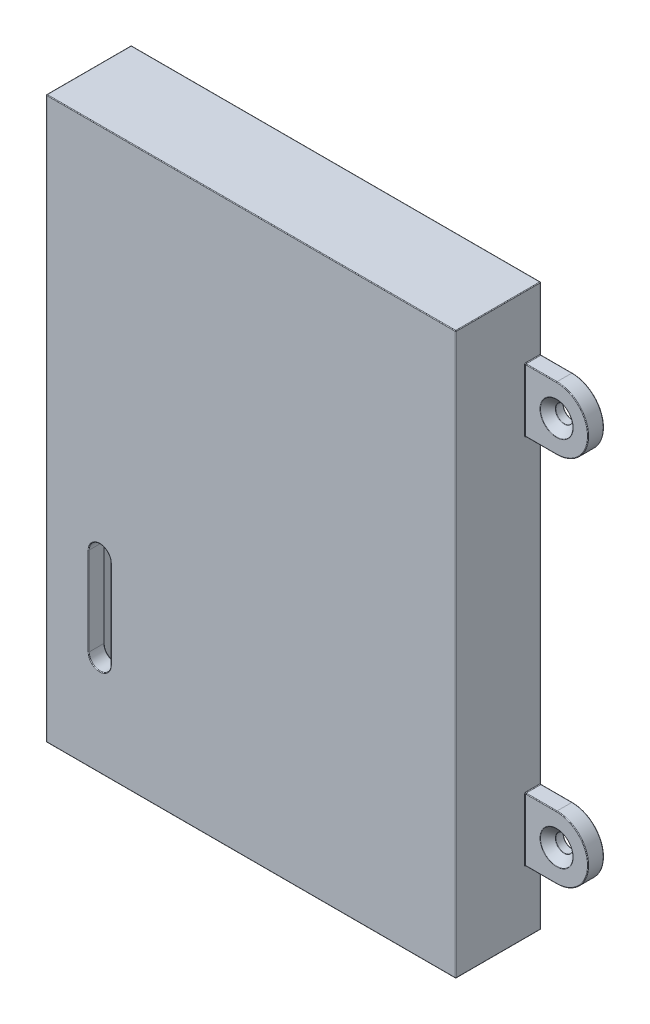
SolidWorks part; units mm, degrees
ref_plane "Ebene vorne" through (0, 0, 0) normal (0, 0, 1) x (1, 0, 0)
ref_plane "Ebene oben" through (0, 0, 0) normal (0, 1, 0) x (1, 0, 0)
ref_plane "Ebene rechts" through (0, 0, 0) normal (1, 0, 0) x (0, 0, -1)
sketch "Skizze2" plane through (0, 0, 0) normal (0, 0, 1) x (1, 0, 0)
  line L0 (-44.4888, 255.9158) -> (-44.4888, -114.3566) construction
  line L1 (-100.4888, 75.2911) -> (29.5112, 75.2911)
  line L2 (-100.4888, 75.2911) -> (-100.4888, -102.7089)
  line L3 (-100.4888, -102.7089) -> (29.5112, -102.7089)
  line L4 (29.5112, 75.2911) -> (29.5112, -102.7089)
  point P7 (-44.4888, 70.7796)
  dimension "D1" = 178
  dimension "D2" = 130
extrude "Aufsatz-Linear austragen1" add sketch "Skizze2" along normal blind 27
sketch "Skizze7" plane through (0, 0, 0) normal (0, 0, 1) x (1, 0, 0)
  line L0 (-103.4013, -18.7089) -> (17.3921, -18.7089) construction
  line L1 (-35.4888, 75.2911) -> (-35.4888, -109.3611) construction
  line L2 (29.5112, 75.2911) -> (-100.4888, 75.2911) construction
  line L3 (39.5112, 45.2911) -> (-110.4888, 45.2911) construction
  line L4 (39.5112, 35.2911) -> (-110.4888, 35.2911)
  line L5 (39.5112, 55.2911) -> (-110.4888, 55.2911)
  line L6 (39.5112, -72.7089) -> (-110.4888, -72.7089) construction
  line L9 (39.5112, -82.7089) -> (-110.4888, -82.7089)
  line L11 (39.5112, -62.7089) -> (-110.4888, -62.7089)
  line L12 (-100.4888, -102.7089) -> (29.5112, -102.7089) construction
  arc A0 (39.5112, 35.2911) -> (39.5112, 55.2911) centre (39.5112, 45.2911) ccw
  arc A1 (-110.4888, 55.2911) -> (-110.4888, 35.2911) centre (-110.4888, 45.2911) ccw
  arc A4 (39.5112, -82.7089) -> (39.5112, -62.7089) centre (39.5112, -72.7089) ccw
  arc A5 (-110.4888, -62.7089) -> (-110.4888, -82.7089) centre (-110.4888, -72.7089) ccw
  point P8 (-35.4888, 45.2911)
  point P17 (-35.4888, -72.7089)
  dimension "D1" = 20
  dimension "D2" = 20
extrude "Aufsatz-Linear austragen2" add sketch "Skizze7" along normal blind 5
shell "Wandung2" thickness 5
sketch "Skizze9" plane through (0, 0, 0) normal (0, 0, 1) x (1, 0, 0)
  line L0 (-110.4888, -72.7089) -> (-110.4888, 45.2911) construction
  line L1 (-110.4888, 45.2911) -> (39.5112, 45.2911) construction
  line L2 (39.5112, 45.2911) -> (39.5112, -72.7089) construction
  line L3 (39.5112, -72.7089) -> (-110.4888, -72.7089) construction
  line L4 (-83.4888, -43.243) -> (-83.4888, -71.243) construction
  line L5 (-79.9888, -43.243) -> (-79.9888, -71.243)
  line L6 (-86.9888, -43.243) -> (-86.9888, -71.243)
  line L7 (-100.4888, 75.2911) -> (-100.4888, -102.7089) construction
  arc A0 (-79.9888, -43.243) -> (-86.9888, -43.243) centre (-83.4888, -43.243) ccw
  arc A1 (-86.9888, -71.243) -> (-79.9888, -71.243) centre (-83.4888, -71.243) ccw
  point P6 (-83.4888, -57.243)
  dimension "D1" = 17
hole_wizard "Formsenkung für M5 Linsensenkschraube mit Schlitz1" positions "Skizze10" profile "Skizze11" countersink size "M5" standard "DIN"
sketch "Skizze10" plane through (0, 0, 5) normal (0, 0, 1) x (1, 0, 0)
  point P0 (-110.4888, 45.2911)
  point P3 (39.5112, 45.2911)
  point P6 (39.5112, -72.7089)
  point P9 (-110.4888, -72.7089)
sketch "Skizze11" plane through (-110.4888, 45.2911, 5) normal (1, 0, 0) x (0, -1, 0)
  line L0 (0, 0) -> (0, 5)
  line L1 (0, 5) -> (2.75, 5)
  line L2 (2.75, 5) -> (2.75, 2.45)
  line L3 (2.75, 2.45) -> (5.2, 0)
  line L5 (5.2, 0) -> (0, 0)
  line L6 (-2.75, 2.45) -> (-5.2, 0) construction
  line L11 (0, -6.35) -> (0, 107.95) construction
  dimension "Bohrerdurchmesser" = 5.5
  dimension "Bohrungstiefe" = 5
  dimension "Senkdurchmesser (Oben)" = 10.4
  dimension "Senkwinkel (Oben)" = 90
extrude "Schnitt-Linear austragen1" cut sketch "Skizze9" along normal through all
fillet "Verrundung1" radius 0.2 55 edges at (-105.4888, 55.2911, 5) (34.5112, -82.7089, 5) (-100.4888, 45.2911, 5) (-120.4888, 45.2911, 5) (-105.4888, 35.2911, 5) (-100.4888, 35.2911, 2.5) (-100.4888, 55.2911, 2.5) (-100.4888, -62.7089, 2.5) (-100.4888, -72.7089, 5) (-105.4888, -62.7089, 5) (-120.4888, -72.7089, 5) (-105.4888, -82.7089, 5) (-100.4888, -82.7089, 2.5) (29.5112, -62.7089, 2.5) (49.5112, -72.7089, 5) (34.5112, -62.7089, 5) (29.5112, -72.7089, 5) (29.5112, -82.7089, 2.5) (29.5112, 45.2911, 5) (29.5112, 35.2911, 2.5) (34.5112, 35.2911, 5) (49.5112, 45.2911, 5) (34.5112, 55.2911, 5) (29.5112, 55.2911, 2.5) (-100.4888, 75.2911, 13.5) (29.5112, 75.2911, 13.5) (29.5112, -102.7089, 13.5) (-100.4888, -102.7089, 13.5) (-100.4888, -92.7089, 0) (-120.4888, -72.7089, 0) (-105.4888, -62.7089, 0) (-105.4888, -82.7089, 0) (-100.4888, -13.7089, 0) (-105.4888, 35.2911, 0) (-120.4888, 45.2911, 0) (-105.4888, 55.2911, 0) (-95.4888, -13.7089, 0) (-100.4888, 65.2911, 0) (-35.4888, 70.2911, 0) (-35.4888, 75.2911, 0) (29.5112, 65.2911, 0) (34.5112, 55.2911, 0) (49.5112, 45.2911, 0) (34.5112, 35.2911, 0) (24.5112, -13.7089, 0) (29.5112, -13.7089, 0) (34.5112, -62.7089, 0) (49.5112, -72.7089, 0) (34.5112, -82.7089, 0) (29.5112, -92.7089, 0) (-35.4888, -102.7089, 0) (29.5112, -13.7089, 27) (-35.4888, -102.7089, 27) (-100.4888, -13.7089, 27) (-35.4888, 75.2911, 27)
fillet "Verrundung2" radius 0.2 20 edges at (42.2612, 45.2911, 0) (42.2612, 45.2911, 2.55) (44.7112, 45.2911, 5) (42.2612, -72.7089, 0) (42.2612, -72.7089, 2.55) (44.7112, -72.7089, 5) (-107.7388, 45.2911, 0) (-107.7388, 45.2911, 2.55) (-105.2888, 45.2911, 5) (-107.7388, -72.7089, 0) (-107.7388, -72.7089, 2.55) (-105.2888, -72.7089, 5) (-79.9888, -57.243, 27) (-79.9888, -57.243, 22) (-83.4888, -39.743, 27) (-83.4888, -39.743, 22) (-86.9888, -57.243, 27) (-86.9888, -57.243, 22) (-83.4888, -74.743, 27) (-83.4888, -74.743, 22)
fillet "Verrundung3" radius 0.2 4 edges at (-35.4888, 70.2911, 22) (24.5112, -13.7089, 22) (-95.4888, -13.7089, 22) (-35.4888, -97.7089, 22)
